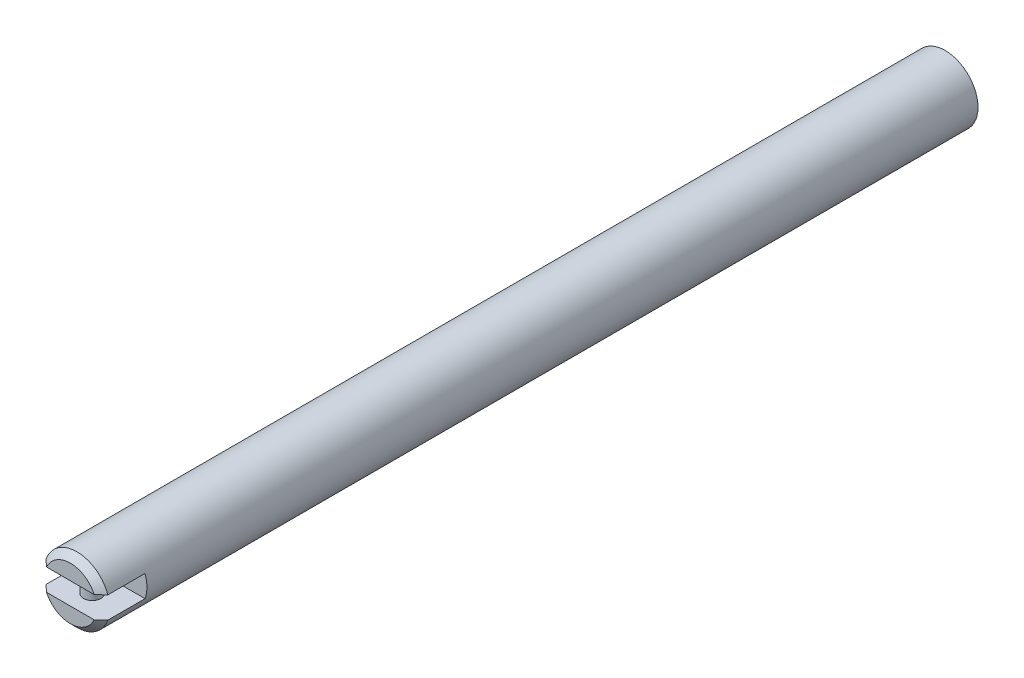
SolidWorks part; units mm, degrees
ref_plane "Plan 1" through (0, 0, 0) normal (0, 0, 1) x (1, 0, 0)
ref_plane "Plan 2" through (0, 0, 0) normal (0, 1, 0) x (1, 0, 0)
ref_plane "Plan 3" through (0, 0, 0) normal (1, 0, 0) x (0, 0, -1)
sketch "Esquisse2" plane through (0, 0, 0) normal (0, 0, 1) x (1, 0, 0)
  circle A0 centre (0, 0) radius 15
  dimension "D1" = 30
extrude "Base-Extrusion" add sketch "Esquisse2" along normal blind 400
sketch "Esquisse3" plane through (0, 0, 400) normal (0, 0, 1) x (1, 0, 0)
  line L0 (-17, 0) -> (18, 0) construction
  line L1 (-14.1421, 5) -> (14.1421, 5)
  line L2 (-14.1421, -5) -> (14.1421, -5)
  circle A0 centre (0, 0) radius 15 construction
  arc A1 (-14.1421, 5) -> (-14.1421, -5) centre (0, 0) ccw
  arc A2 (14.1421, -5) -> (14.1421, 5) centre (0, 0) ccw
  dimension "D1" = 10
extrude "Enlèv. mat.-Extru.1" cut sketch "Esquisse3" against normal blind 20
sketch "Esquisse4" plane through (0, -5, 0) normal (0, 1, 0) x (-1, 0, 0)
  line L0 (0, 105.0125) -> (0, 15.5211) construction
  line L1 (0, 400) -> (0, 380) construction
  line L2 (14.1421, 400) -> (-14.1421, 400) construction
  circle A0 centre (0, 390) radius 4
  dimension "D1" = 8
  dimension "D2" = 10
extrude "Boss.-Extru.1" add sketch "Esquisse4" along normal up to next
chamfer "Chanfrein1" distance 3 angle 45 2 edges at (0, 15, 400) (0, -15, 400)
sketch "Esq_WRNL_Compact001" plane through (0, 0, 0) normal (0, 0, 1) x (1, 0, 0)
  line L0 (-16, -16) -> (-16, 16)
  line L1 (16, -16) -> (16, 16)
  line L2 (-16, -16) -> (16, -16)
  line L3 (-16, 16) -> (16, 16)
